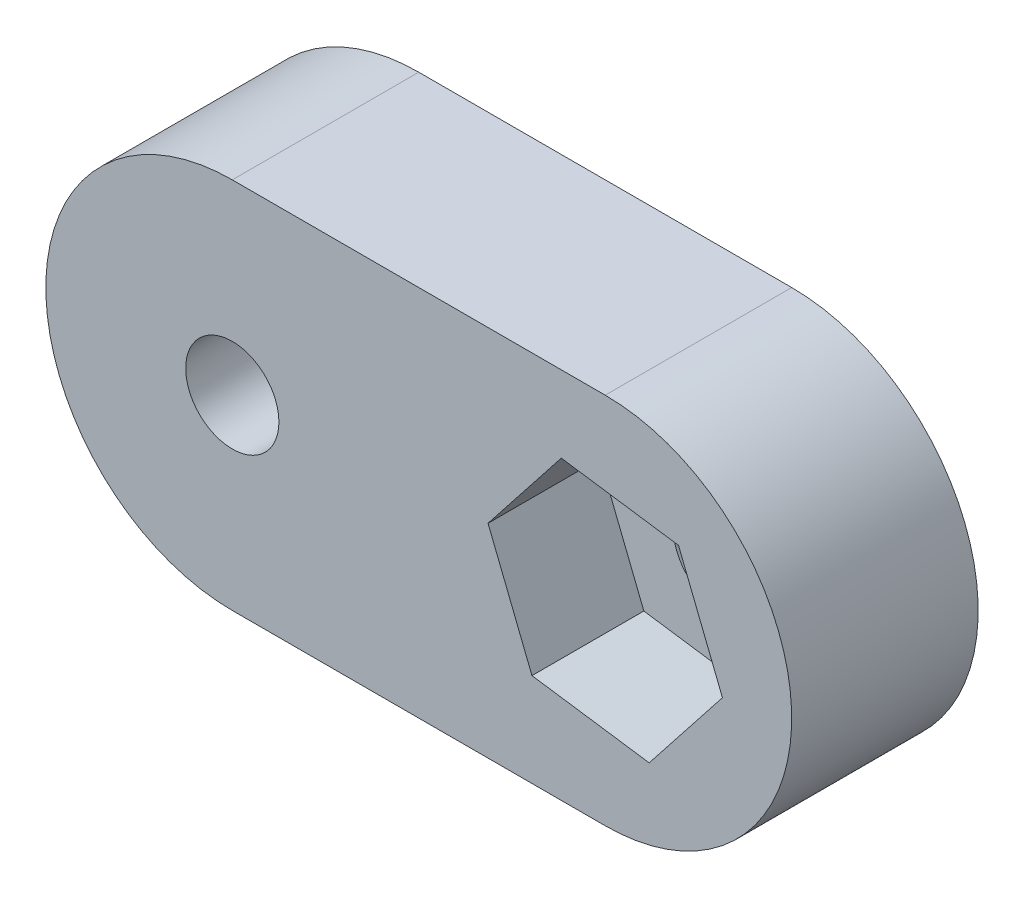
SolidWorks part; units mm, degrees
ref_plane "Alzado" through (0, 0, 0) normal (0, 0, 1) x (1, 0, 0)
ref_plane "Planta" through (0, 0, 0) normal (0, 1, 0) x (1, 0, 0)
ref_plane "Vista lateral" through (0, 0, 0) normal (1, 0, 0) x (0, 0, -1)
sketch "Croquis1" plane through (0, 0, 0) normal (0, 0, 1) x (1, 0, 0)
  line L0 (0, 0) -> (10, 0) construction
  line L1 (-1.9645, 2.4948) -> (-3.1428, -0.4539)
  line L2 (-3.1428, -0.4539) -> (-1.1783, -2.9487)
  line L3 (-1.1783, -2.9487) -> (1.9645, -2.4948)
  line L4 (1.9645, -2.4948) -> (3.1428, 0.4539)
  line L5 (3.1428, 0.4539) -> (1.1783, 2.9487)
  line L6 (1.1783, 2.9487) -> (-1.9645, 2.4948)
  line L7 (5, 0) -> (5, 2.6756) construction
  line L8 (13.1428, -0.4539) -> (11.1783, -2.9487)
  line L9 (11.9645, 2.4948) -> (13.1428, -0.4539)
  line L10 (8.8217, 2.9487) -> (11.9645, 2.4948)
  line L11 (6.8572, 0.4539) -> (8.8217, 2.9487)
  line L12 (8.0355, -2.4948) -> (6.8572, 0.4539)
  line L13 (11.1783, -2.9487) -> (8.0355, -2.4948)
  line L14 (0, 0) -> (10, 0) construction
  line L15 (0, 5) -> (10, 5)
  line L16 (0, -5) -> (10, -5)
  circle A0 centre (0, 0) radius 2.75 construction
  circle A2 centre (10, 0) radius 2.75 construction
  arc A3 (0, 5) -> (0, -5) centre (0, 0) ccw
  arc A4 (10, -5) -> (10, 5) centre (10, 0) ccw
  point P20 (5, 0)
  dimension "D1" = 5.5
  dimension "D2" = 10
  dimension "D3" = 10
extrude "Saliente-Extruir1" add sketch "Croquis1" along normal blind 5
sketch "Croquis2" plane through (0, 0, 5) normal (0, 0, 1) x (1, 0, 0)
  line L0 (3.1428, 0.4539) -> (1.1783, 2.9487) construction
  line L1 (1.9645, -2.4948) -> (3.1428, 0.4539) construction
  line L2 (-1.1783, -2.9487) -> (1.9645, -2.4948) construction
  line L3 (-3.1428, -0.4539) -> (-1.1783, -2.9487) construction
  line L4 (-1.9645, 2.4948) -> (-3.1428, -0.4539) construction
  line L5 (1.1783, 2.9487) -> (-1.9645, 2.4948) construction
  line L6 (3.1428, 0.4539) -> (1.1783, 2.9487)
  line L7 (1.9645, -2.4948) -> (3.1428, 0.4539)
  line L8 (-1.1783, -2.9487) -> (1.9645, -2.4948)
  line L9 (-3.1428, -0.4539) -> (-1.1783, -2.9487)
  line L10 (-1.9645, 2.4948) -> (-3.1428, -0.4539)
  line L11 (1.1783, 2.9487) -> (-1.9645, 2.4948)
  circle A0 centre (0, 0) radius 1.25
  dimension "D1" = 2.5
extrude "Saliente-Extruir2" add sketch "Croquis2" against normal blind 2
sketch "Croquis3" plane through (0, 0, 0) normal (0, 0, -1) x (-1, 0, 0)
  line L0 (-8.0355, -2.4948) -> (-12.1252, 2.0927) construction
  line L1 (-13.1428, -0.4539) -> (-11.9645, 2.4948) construction
  line L2 (-11.1783, -2.9487) -> (-13.1428, -0.4539) construction
  line L3 (-11.9645, 2.4948) -> (-8.8217, 2.9487) construction
  line L4 (-8.8217, 2.9487) -> (-6.8572, 0.4539) construction
  line L5 (-6.8572, 0.4539) -> (-8.0355, -2.4948) construction
  line L6 (-8.0355, -2.4948) -> (-11.1783, -2.9487) construction
  line L7 (-11.1783, -2.9487) -> (-13.1428, -0.4539)
  line L8 (-13.1428, -0.4539) -> (-11.9645, 2.4948)
  line L9 (-11.9645, 2.4948) -> (-8.8217, 2.9487)
  line L10 (-8.8217, 2.9487) -> (-6.8572, 0.4539)
  line L11 (-6.8572, 0.4539) -> (-8.0355, -2.4948)
  line L12 (-8.0355, -2.4948) -> (-11.1783, -2.9487)
  circle A0 centre (-10.0803, -0.201) radius 1.25
  dimension "D1" = 2.5
extrude "Saliente-Extruir3" add sketch "Croquis3" against normal blind 2
